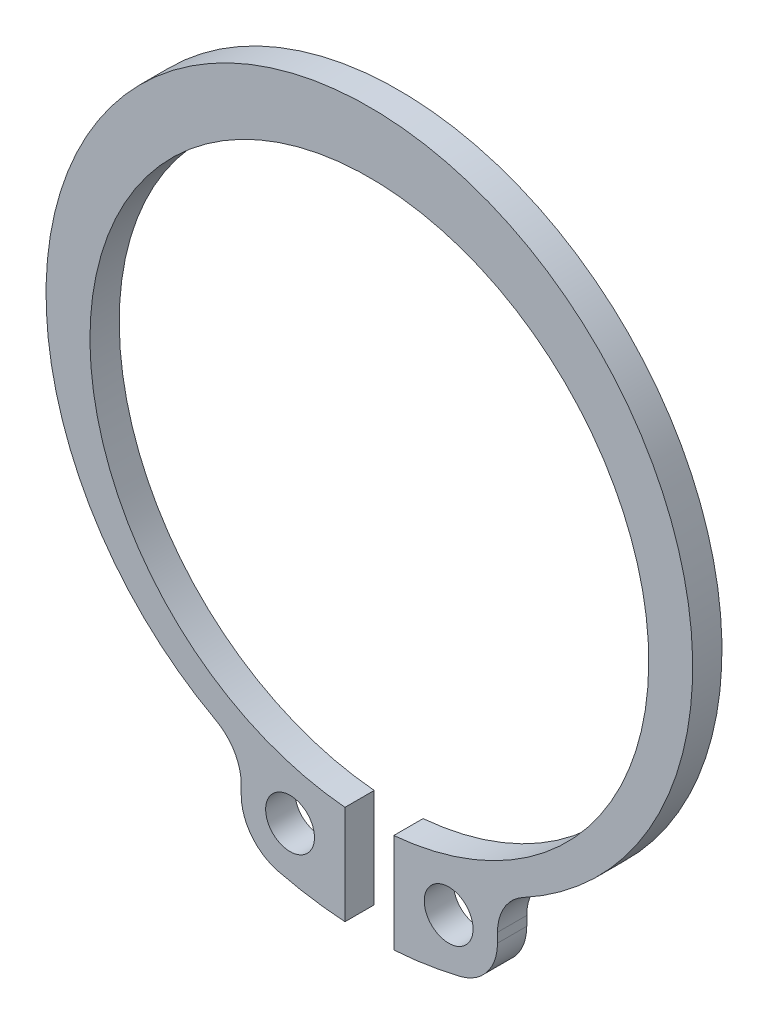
SolidWorks part; units mm, degrees
ref_plane "Plan1" through (0, 0, 0) normal (0, 0, 1) x (1, 0, 0)
ref_plane "Plan2" through (0, 0, 0) normal (0, 1, 0) x (1, 0, 0)
ref_plane "Plan3" through (0, 0, 0) normal (1, 0, 0) x (0, 0, -1)
sketch "Esquisse1" plane through (0, 0, 0) normal (0, 0, 1) x (1, 0, 0)
  line L0 (-1, -11.4062) -> (-1, -15.4677)
  line L1 (1, -11.4062) -> (1, -15.4677)
  line L2 (5.25, -12.7164) -> (5.25, -13.103)
  line L3 (-5.25, -12.7164) -> (-5.25, -13.103)
  arc A0 (1, -11.4062) -> (-1, -11.4062) centre (0, 0) ccw
  arc A1 (1, -15.4677) -> (3.7315, -15.0441) centre (0, 0) ccw
  arc A2 (6.2992, -10.9569) -> (-6.2992, -10.9569) centre (0, 0.7) ccw
  arc A3 (-3.7315, -15.0441) -> (-1, -15.4677) centre (0, 0) ccw
  arc A4 (3.7315, -15.0441) -> (5.25, -13.103) centre (3.25, -13.103) ccw
  arc A5 (6.2992, -10.9569) -> (5.25, -12.7164) centre (7.25, -12.7164) ccw
  arc A6 (-6.2992, -10.9569) -> (-5.25, -12.7164) centre (-7.25, -12.7164) cw
  arc A7 (-3.7315, -15.0441) -> (-5.25, -13.103) centre (-3.25, -13.103) cw
  circle A8 centre (3.25, -13.103) radius 1
  circle A9 centre (-3.25, -13.103) radius 1
  point P19 (-5.25, -14.5838)
  dimension "D1" = 22.9
  dimension "D2" = 31
  dimension "D3" = 26.5
  dimension "D4" = 2.5
  dimension "D7" = 2
  dimension "D8" = 2
  dimension "D9" = 2
  dimension "D5" = 2
  dimension "D6" = 10.5
extrude "Base-Extrusion" add sketch "Esquisse1" along normal blind 1.2
